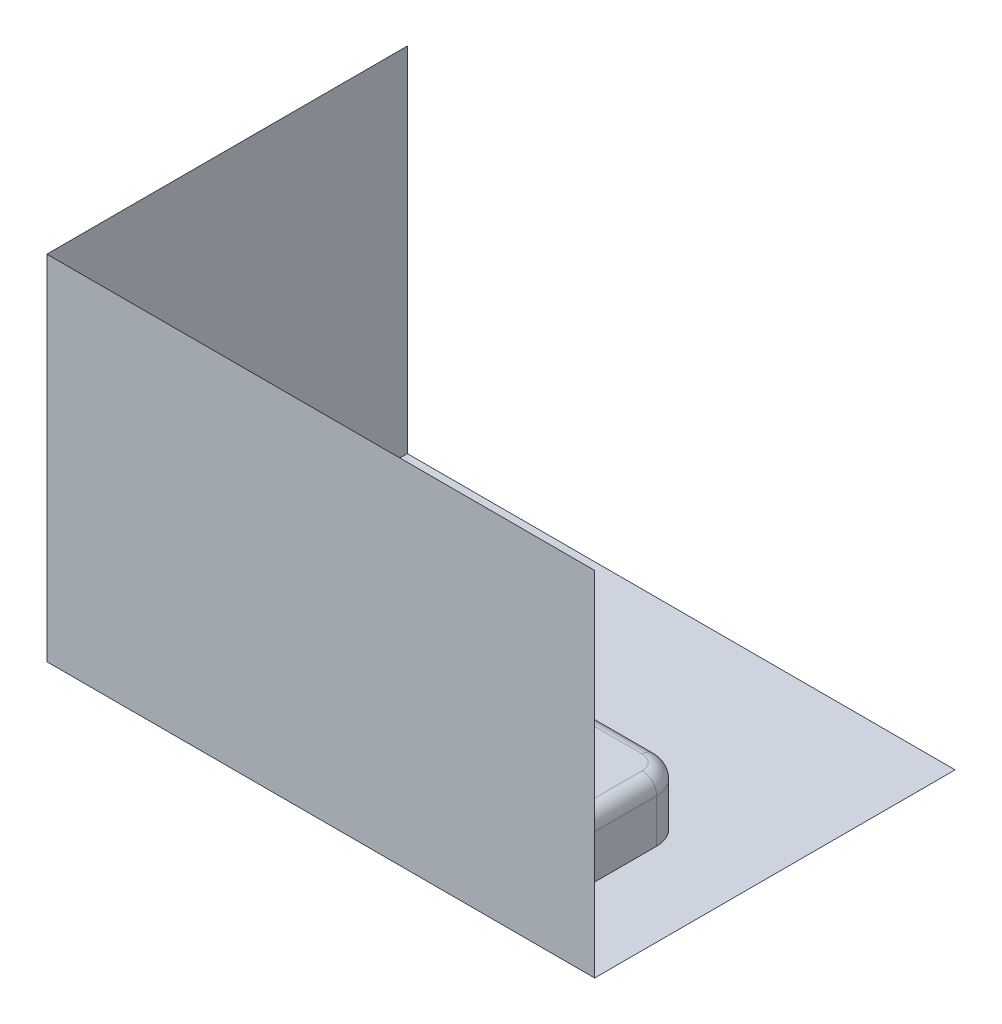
SolidWorks part; units mm, degrees
ref_plane "Plane1" through (0, 0, 0) normal (0, 0, 1) x (1, 0, 0)
ref_plane "Plane2" through (0, 0, 0) normal (0, 1, 0) x (1, 0, 0)
ref_plane "Plane3" through (0, 0, 0) normal (1, 0, 0) x (0, 0, -1)
sketch "Sketch1" plane through (0, 0, 0) normal (0, 1, 0) x (1, 0, 0)
  line L1 (0, 0) -> (101.6, 0)
  line L2 (0, 0) -> (0, 38.1)
  line L3 (0, 38.1) -> (101.6, 38.1)
  line L4 (101.6, 0) -> (101.6, 38.1)
  dimension "D1" = 101.6
  dimension "D2" = 38.1
extrude "Base-Extrude" add sketch "Sketch1" along normal blind 12.7
sketch "Sketch2" plane through (0, 0, 0) normal (0, 0, 1) x (1, 0, 0)
  line L0 (50.8, 0) -> (50.8, 66.8931) construction
  line L1 (0, 0) -> (101.6, 0) construction
  line L2 (31.75, 0) -> (31.75, 38.1)
  line L3 (69.85, 38.1) -> (69.85, 0)
  line L4 (69.85, 0) -> (31.75, 0)
  arc A0 (31.75, 38.1) -> (69.85, 38.1) centre (50.8, 38.1) cw
  dimension "D1" = 19.05
  dimension "D2" = 38.1
extrude "Boss-Extrude1" add sketch "Sketch2" against normal blind 12.7
hole_wizard "CBORE for 1/4 Hex Head Bolt1" positions "Sketch8" profile "Sketch9" counterbore size "1/4" standard "Ansi Inch"
sketch "Sketch8" plane through (1.1036, -5.641, 0) normal (0, 0, 1) x (1, 0, 0)
  point P0 (49.6964, 43.741)
sketch "Sketch9" plane through (50.8, 38.1, 0) normal (1, 0, 0) x (0, -1, 0)
  line L0 (0, 0) -> (0, 38.1)
  line L1 (0, 38.1) -> (3.3782, 38.1)
  line L3 (3.3782, 38.1) -> (3.3782, 4.7752)
  line L4 (3.3782, 4.7752) -> (9.525, 4.7752)
  line L5 (9.525, 4.7752) -> (9.525, 0)
  line L7 (9.525, 0) -> (0, 0)
  line L11 (0, -6.35) -> (0, 107.95) construction
  dimension "Thru Hole Dia." = 6.7564
  dimension "Thru Hole Depth" = 38.1
  dimension "C'Bore Dia." = 19.05
  dimension "C'Bore Depth" = 4.7752
sketch "Sketch10" plane through (-1.0713, 1.1621, 0) normal (0, 0, 1) x (1, 0, 0)
  line L1 (32.8213, -1.1621) -> (70.9213, -1.1621)
  line L2 (32.8213, -1.1621) -> (32.8213, 2.0129)
  line L3 (32.8213, 2.0129) -> (70.9213, 2.0129)
  line L4 (70.9213, -1.1621) -> (70.9213, 2.0129)
  line L8 (70.9213, 11.5379) -> (70.9213, 36.9379) construction
  line L9 (32.8213, 36.9379) -> (32.8213, 11.5379) construction
  line L11 (1.0713, -1.1621) -> (102.6713, -1.1621) construction
  dimension "D1" = 3.175
extrude "Cut-Extrude1" cut sketch "Sketch10" against normal through all
hole_wizard "9/32 (0.28125) Diameter Hole1" positions "Sketch11" profile "Sketch12" hole size "9/32" standard "Ansi Inch"
sketch "Sketch11" plane through (45.9081, 12.7, 7.8552) normal (0, 1, 0) x (-1, 0, 0)
  line L4 (45.9081, -45.9552) -> (45.9081, -7.8552) construction
  line L6 (-55.6919, -7.8552) -> (-55.6919, -45.9552) construction
  line L7 (-55.6919, -45.9552) -> (45.9081, -45.9552) construction
  point P0 (-42.9919, -33.2552)
  point P1 (33.2081, -33.2552)
  dimension "D1" = 12.7
  dimension "D2" = 12.7
  dimension "D3" = 12.7
sketch "Sketch12" plane through (88.9, 12.7, -25.4) normal (1, 0, 0) x (0, 0, 1)
  line L0 (0, 0) -> (0, 12.7)
  line L1 (0, 12.7) -> (3.5719, 12.7)
  line L2 (3.5719, 12.7) -> (3.5719, 0)
  line L5 (3.5719, 0) -> (0, 0)
  line L11 (0, -6.35) -> (0, 107.95) construction
  dimension "Thru Hole Dia." = 7.1437
  dimension "Thru Hole Depth" = 12.7
fillet "Fillet1" radius 6.35 10 edges at (31.75, 1.5875, -38.1) (31.75, 3.175, -19.05) (69.85, 1.5875, -38.1) (69.85, 3.175, -19.05) (31.75, 1.5875, 0) (69.85, 1.5875, 0) (0, 6.35, -38.1) (101.6, 6.35, -38.1) (101.6, 6.35, 0) (0, 6.35, 0)
fillet "Fillet2" radius 3.175 18 edges at (82.55, 12.7, 0) (31.75, 25.4, -12.7) (69.85, 25.4, -12.7) (31.75, 25.4, 0) (69.85, 25.4, 0) (50.8, 57.15, 0) (31.75, 12.7, -6.35) (50.8, 57.15, -12.7) (69.85, 12.7, -6.35) (50.8, 12.7, -12.7) (19.05, 12.7, 0) (0, 12.7, -19.05) (101.6, 12.7, -19.05) (50.8, 12.7, -38.1) (1.8599, 12.7, -36.2401) (99.7401, 12.7, -36.2401) (99.7401, 12.7, -1.8599) (1.8599, 12.7, -1.8599)
sketch "Sketch5" plane through (0, 0, 0) normal (0, 0, -1) x (-1, 0, 0)
  line L0 (0, 0) -> (0, 9.525) construction
  line L1 (0, 77.1809) -> (-119.7743, 77.1809)
  line L2 (0, 77.1809) -> (0, 0)
  line L3 (0, 0) -> (-119.7743, 0)
  line L4 (-119.7743, 77.1809) -> (-119.7743, 0)
  line L5 (-6.35, 0) -> (-31.75, 0) construction
surface "Surface-Plane1" sketch "Sketch5"
sketch "Sketch6" plane through (0, 0, 0) normal (-1, 0, 0) x (0, 0, 1)
  line L1 (-78.8266, 77.1809) -> (0, 77.1809)
  line L2 (-78.8266, 77.1809) -> (-78.8266, 0)
  line L3 (-78.8266, 0) -> (0, 0)
  line L4 (0, 77.1809) -> (0, 0)
surface "Surface-Plane2" sketch "Sketch6"
sketch "Sketch7" plane through (0, 0, 0) normal (0, -1, 0) x (1, 0, 0)
  line L1 (0, 0) -> (119.7743, 0)
  line L2 (0, 0) -> (0, -78.8266)
  line L3 (0, -78.8266) -> (119.7743, -78.8266)
  line L4 (119.7743, 0) -> (119.7743, -78.8266)
surface "Surface-Plane3" sketch "Sketch7"
